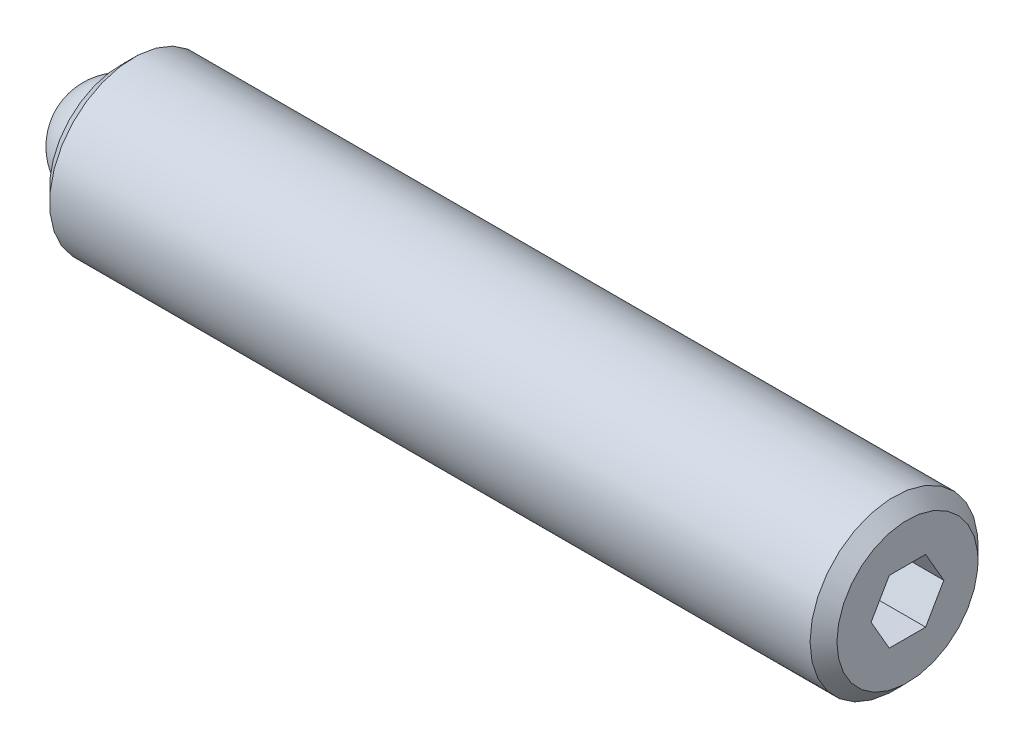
SolidWorks part; units mm, degrees
ref_plane "Front Plane" through (0, 0, 0) normal (0, 0, 1) x (1, 0, 0)
ref_plane "Top Plane" through (0, 0, 0) normal (0, 1, 0) x (1, 0, 0)
ref_plane "Right Plane" through (0, 0, 0) normal (1, 0, 0) x (0, 0, -1)
sketch "Sketch2" plane through (0, 0, 0) normal (1, 0, 0) x (0, 0, -1)
  circle A0 centre (0, 0) radius 3.175
  dimension "D1" = 6.35
extrude "Boss-Extrude1" add sketch "Sketch2" along normal blind 29.7656
sketch "Sketch3" plane through (0, 0, 0) normal (-1, 0, 0) x (0, 0, 1)
  circle A0 centre (0, 0) radius 1.9812
  dimension "D1" = 3.9624
chamfer "Chamfer1" distance 0.508 angle 45 1 edges at (0, 0, -3.175)
chamfer "Chamfer2" distance 0.508 angle 45 1 edges at (29.7656, 0, -3.175)
sketch "Sketch4" plane through (29.7656, 0, 0) normal (1, 0, 0) x (0, 0, -1)
  line L1 (1.3748, 0) -> (0.6874, 1.1906)
  line L2 (0.6874, 1.1906) -> (-0.6874, 1.1906)
  line L3 (-0.6874, 1.1906) -> (-1.3748, 0)
  line L4 (-1.3748, 0) -> (-0.6874, -1.1906)
  line L5 (-0.6874, -1.1906) -> (0.6874, -1.1906)
  line L6 (0.6874, -1.1906) -> (1.3748, 0)
  circle A0 centre (0, 0) radius 1.1906 construction
  dimension "D1" = 2.3813
extrude "Cut-Extrude2" cut sketch "Sketch4" against normal blind 2.286
extrude "Cut-Extrude3" cut sketch "Sketch3" against normal blind 1.9844
sketch "Sketch5" plane through (0, 0, 0) normal (-1, 0, 0) x (0, 0, 1)
  line L0 (0, 0) -> (0, -1.9844)
  line L1 (0, 0) -> (0, 1.9844)
  arc A0 (0, 1.9844) -> (0, -1.9844) centre (0, 0) ccw
  dimension "D1" = 1.9844
revolve "Revolve1" add sketch "Sketch5" angle 360 about L1
sketch "Sketch6" plane through (0, 0, 0) normal (-1, 0, 0) x (0, 0, 1)
  line L0 (0, 0) -> (0, 1.9812) construction
  circle A0 centre (0, 0) radius 1.9812 construction
  arc A1 (0.0635, 1.9802) -> (-0.0635, 1.9802) centre (0, 0) ccw
  arc A2 (0.0635, 1.9802) -> (-0.0635, 1.9802) centre (0, 1.9812) ccw
  dimension "D1" = 0.127
extrude "Cut-Extrude4" cut sketch "Sketch6" against normal up to surface (1.9844 mm away) contours A2 A1
